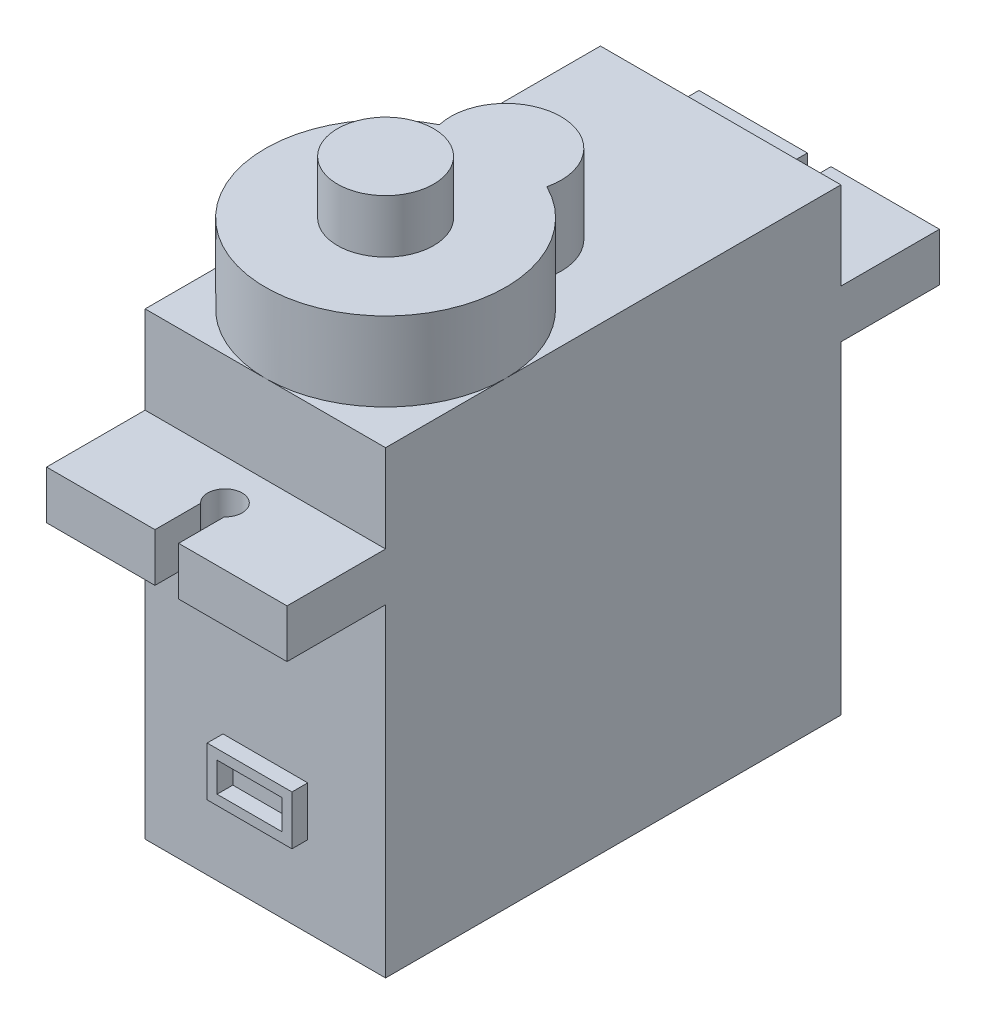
SolidWorks part; units mm, degrees
ref_plane "Plan de face" through (0, 0, 0) normal (0, 0, 1) x (1, 0, 0)
ref_plane "Plan de dessus" through (0, 0, 0) normal (0, 1, 0) x (1, 0, 0)
ref_plane "Plan de droite" through (0, 0, 0) normal (1, 0, 0) x (0, 0, -1)
sketch "Esquisse1" plane through (0, 0, 0) normal (1, 0, 0) x (0, 0, -1)
  line L0 (0, -9.5432) -> (0, 26.3061) construction
  line L1 (-6.5687, 0) -> (43.0147, 0) construction
  line L2 (-6.5687, 23.3) -> (43.0147, 23.3) construction
  line L3 (23.1, -9.5432) -> (23.1, 26.3061) construction
  line L4 (11.55, 26.3061) -> (11.55, 16.4856) construction
  line L5 (18.1943, 18.85) -> (34.5394, 18.85) construction
  line L6 (18.1943, 16.4) -> (34.5394, 16.4) construction
  line L7 (23.1, 23.3) -> (23.1, 18.85)
  line L8 (28.1, 26.3061) -> (28.1, -9.5432) construction
  line L9 (23.1, 18.85) -> (28.1, 18.85)
  line L10 (28.1, 18.85) -> (28.1, 16.4)
  line L11 (28.1, 16.4) -> (23.1, 16.4)
  line L12 (23.1, 16.4) -> (23.1, 0)
  line L13 (0, 16.4) -> (0, 0)
  line L14 (-5, 16.4) -> (0, 16.4)
  line L15 (-5, 18.85) -> (-5, 16.4)
  line L16 (0, 18.85) -> (-5, 18.85)
  line L17 (0, 23.3) -> (0, 18.85)
  line L18 (0, 0) -> (23.1, 0)
  line L19 (0, 23.3) -> (23.1, 23.3)
  dimension "D1" = 23.1
  dimension "D2" = 23.3
  dimension "D3" = 5
  dimension "D4" = 4.45
  dimension "D5" = 2.45
  dimension "D6" = 11.55
extrude "Boss.-Extru.1" add sketch "Esquisse1" along normal blind 12.2
sketch "Esquisse2" plane through (0, 23.3, 0) normal (0, 1, 0) x (1, 0, 0)
  line L0 (6.1, -3.0777) -> (6.1, 12.8836) construction
  line L1 (18.2298, 0) -> (-0.4412, 0) construction
  line L2 (18.2298, 6.1) -> (4.1736, 6.1) construction
  arc A0 (3.3747, 11.5574) -> (8.8253, 11.5574) centre (6.1, 6.1) ccw
  arc A1 (8.8253, 11.5574) -> (3.3747, 11.5574) centre (6.1, 12.2) ccw
  dimension "D1" = 6.1
extrude "Boss.-Extru.2" add sketch "Esquisse2" along normal blind 4
sketch "Esquisse3" plane through (0, 27.3, 0) normal (0, 1, 0) x (1, 0, 0)
  circle A0 centre (6.1, 6.1) radius 2.44
extrude "Boss.-Extru.3" add sketch "Esquisse3" along normal blind 2.7
sketch "Esquisse4" plane through (0, 0, 0) normal (0, 0, 1) x (1, 0, 0)
  line L0 (6.1, -2.2335) -> (6.1, 8.3432) construction
  line L1 (17.3465, 0) -> (-0.7202, 0) construction
  line L2 (17.2202, 6.6) -> (-0.7202, 6.6) construction
  line L3 (14.6657, 4.1) -> (-1.6138, 4.1) construction
  line L4 (8.25, -6.3433) -> (8.25, 7.9158) construction
  line L5 (3.95, -6.3433) -> (3.95, 7.9158) construction
  line L7 (3.95, 4.1) -> (8.25, 4.1)
  line L8 (3.95, 4.1) -> (3.95, 6.6)
  line L9 (3.95, 6.6) -> (8.25, 6.6)
  line L10 (8.25, 4.1) -> (8.25, 6.6)
  line L11 (4.45, 4.6) -> (7.75, 4.6)
  line L12 (4.45, 4.6) -> (4.45, 6.1)
  line L13 (4.45, 6.1) -> (7.75, 6.1)
  line L14 (7.75, 4.6) -> (7.75, 6.1)
  dimension "D1" = 6.6
  dimension "D2" = 2.5
  dimension "D3" = 4.3
  dimension "D4" = 2.15
  dimension "D5" = 0.5
  dimension "D6" = 0.5
extrude "Boss.-Extru.4" add sketch "Esquisse4" along normal blind 0.8
sketch "Esquisse5" plane through (0, 18.85, 0) normal (0, 1, 0) x (1, 0, 0)
  line L0 (19.3997, 28.1) -> (-1.0099, 28.1) construction
  line L1 (6.1, -6.293) -> (6.1, 15.4135) construction
  line L2 (6.7, -8.6928) -> (6.7, 1.5335) construction
  line L3 (5.5, -8.6928) -> (5.5, 2.2393) construction
  line L4 (1.9214, -2.05) -> (18.6917, -2.05) construction
  line L5 (12.2, 0) -> (6.1, 0) construction
  line L6 (5.5, -2.6865) -> (5.5, -5)
  line L7 (5.5, -5) -> (6.7, -5)
  line L8 (12.2, -5) -> (0, -5) construction
  line L9 (6.7, -5) -> (6.7, -2.6865)
  line L10 (5.5, 25.7865) -> (5.5, 28.1)
  line L11 (6.7, 28.1) -> (6.7, 25.7865)
  line L12 (5.5, 28.1) -> (6.7, 28.1)
  line L13 (12.2, -5) -> (-4.6687, -5) construction
  line L15 (12.2, 23.1) -> (0, 23.1) construction
  arc A0 (6.7, -2.6865) -> (5.5, -2.6865) centre (6.1, -2.05) ccw
  arc A1 (6.7, 25.7865) -> (5.5, 25.7865) centre (6.1, 25.05) cw
  dimension "D1" = 1.2
  dimension "D3" = 1.95
  dimension "D4" = 2.05
  dimension "D2" = 0.6
extrude "Enlèv. mat.-Extru.3" cut sketch "Esquisse5" against normal blind 2.5
